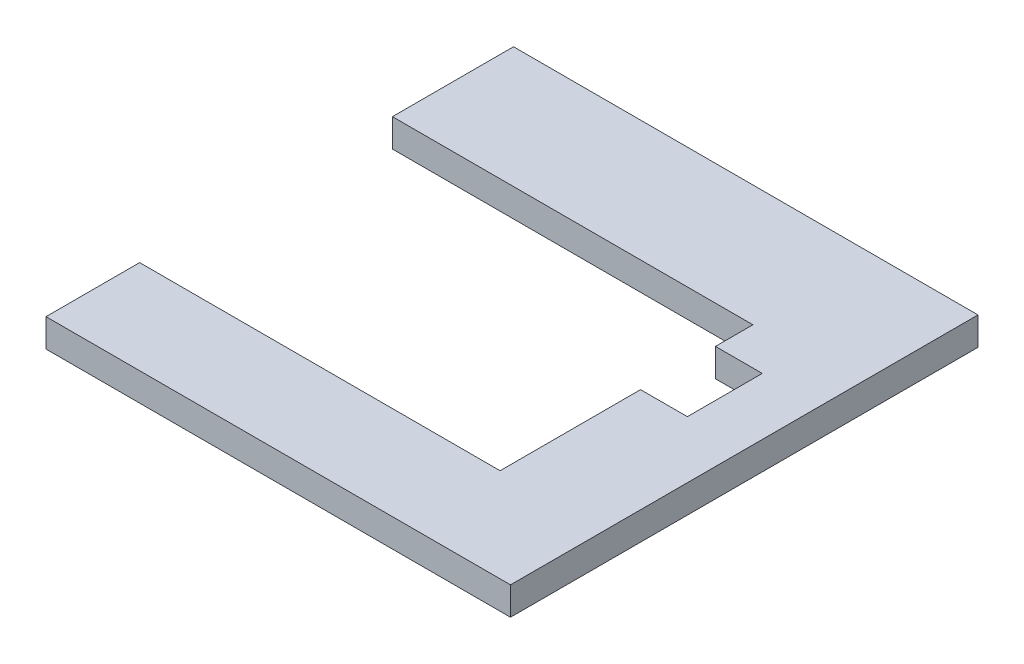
SolidWorks part; units mm, degrees
ref_plane "Alzado" through (0, 0, 0) normal (0, 0, 1) x (1, 0, 0)
ref_plane "Planta" through (0, 0, 0) normal (0, 1, 0) x (1, 0, 0)
ref_plane "Vista lateral" through (0, 0, 0) normal (1, 0, 0) x (0, 0, -1)
sketch "Sketch1" plane through (0, 0, 0) normal (0, 1, 0) x (1, 0, 0)
  line L2 (0, 0) -> (0, 10)
  line L20 (0, 0) -> (49.6102, 0)
  line L23 (0, 37) -> (0, 49.932)
  line L24 (0, 10) -> (38.5, 10)
  line L26 (0, 37) -> (38.5, 37)
  line L27 (38.5, 10) -> (38.5, 25)
  line L28 (38.5, 33) -> (38.5, 37)
  line L29 (38.5, 33) -> (43.5, 33)
  line L31 (38.5, 25) -> (43.5, 25)
  line L32 (43.5, 33) -> (43.5, 25)
  line L37 (0, 49.932) -> (49.6102, 49.932)
  line L38 (49.6102, 49.932) -> (49.6102, 0)
  dimension "D9" = 38.5
  dimension "D10" = 37
  dimension "D11" = 10
  dimension "D12" = 5
  dimension "D13" = 8
  dimension "D14" = 4
extrude "Boss-Extrude1" add sketch "Sketch1" along normal blind 3
